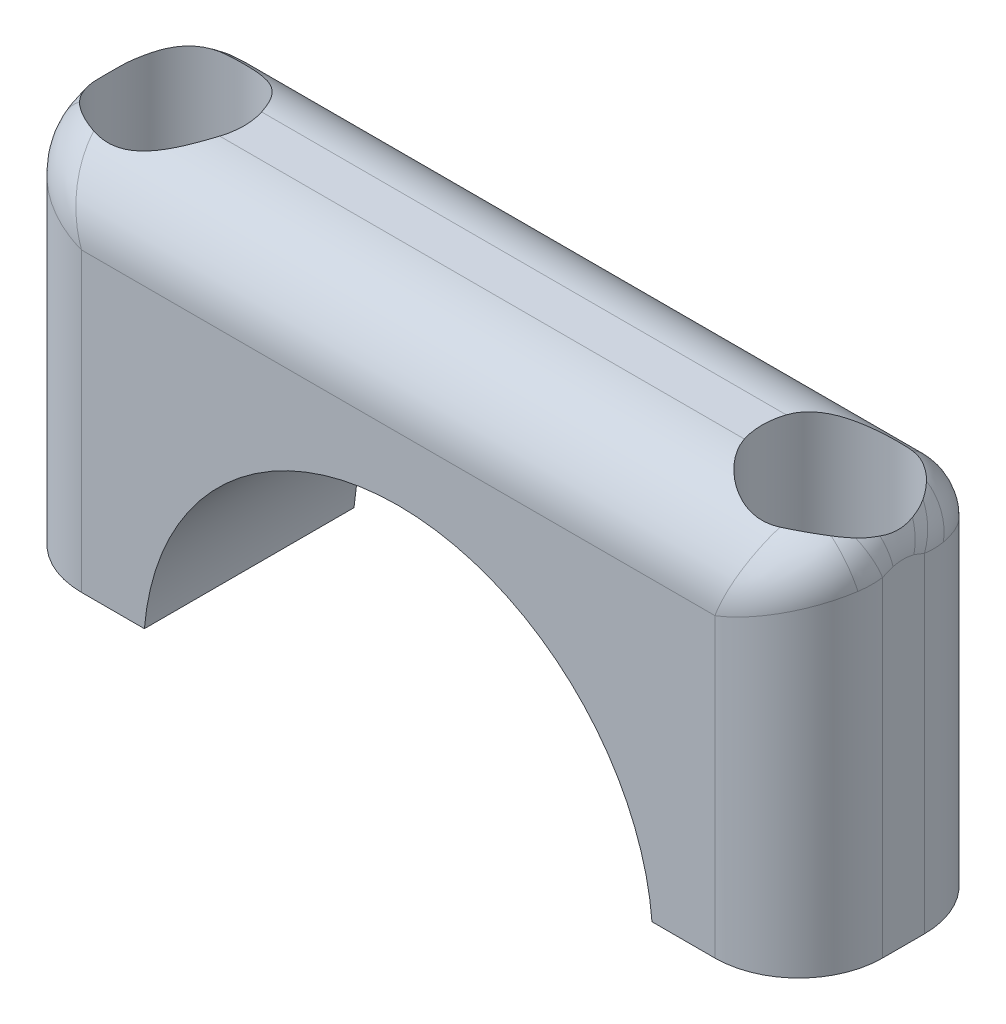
SolidWorks part; units mm, degrees
ref_plane "Front Plane" through (0, 0, 0) normal (0, 0, 1) x (1, 0, 0)
ref_plane "Top Plane" through (0, 0, 0) normal (0, 1, 0) x (1, 0, 0)
ref_plane "Right Plane" through (0, 0, 0) normal (1, 0, 0) x (0, 0, -1)
sketch "Sketch1" plane through (0, 0, 0) normal (0, 0, 1) x (1, 0, 0)
  line L0 (-19.1088, 1) -> (-12.1088, 1)
  line L1 (12.1088, 1) -> (19.1088, 1)
  line L2 (55, 0) -> (-55, 0) construction
  line L3 (0, 12.15) -> (0, 19.15) construction
  line L4 (-19.1088, 1) -> (-19.1088, 19.15)
  line L5 (-19.1088, 19.15) -> (19.1088, 19.15)
  line L6 (19.1088, 19.15) -> (19.1088, 1)
  circle A0 centre (0, 0) radius 12.15 construction
  arc A1 (-12.1088, 1) -> (12.1088, 1) centre (0, 0) cw
  dimension "D1" = 24.3
  dimension "D2" = 1
  dimension "D3" = 7
extrude "Boss-Extrude1" add sketch "Sketch1" along normal mid plane 10
sketch "Sketch2" plane through (0, 1, 0) normal (0, -1, 0) x (1, 0, 0)
  line L0 (-15.6088, 5) -> (-15.6088, -5) construction
  line L1 (-19.1088, 5) -> (-12.1088, 5) construction
  line L2 (-19.1088, -5) -> (-12.1088, -5) construction
  line L3 (15.6088, 5) -> (15.6088, -5) construction
  line L4 (12.1088, 5) -> (19.1088, 5) construction
  line L5 (12.1088, -5) -> (19.1088, -5) construction
  circle A0 centre (-15.6088, 0) radius 2.25
  circle A1 centre (15.6088, 0) radius 2.25
  dimension "D1" = 4.5
extrude "Cut-Extrude1" cut sketch "Sketch2" against normal through all
fillet "Fillet1" radius 4 6 edges at (0, 19.15, -5) (0, 19.15, 5) (19.1088, 10.075, -5) (19.1088, 10.075, 5) (-19.1088, 10.075, -5) (-19.1088, 10.075, 5)
fillet "Fillet2" radius 2.5 6 edges at (17.9372, 17.9784, -3.8284) (-17.9372, 17.9784, -3.8284) (17.9372, 17.9784, 3.8284) (-17.9372, 17.9784, 3.8284) (19.1088, 19.15, 0) (-19.1088, 19.15, 0)
ref_plane "Plane1" through (0, 10, 0) normal (0, 1, 0) x (1, 0, 0)
sketch "Sketch4" plane through (0, 10, 0) normal (0, 1, 0) x (1, 0, 0)
  circle A0 centre (-15.6088, 0) radius 3.25
  circle A1 centre (15.6088, 0) radius 3.25
  dimension "D1" = 6.5
extrude "Cut-Extrude3" cut sketch "Sketch4" along normal through all
